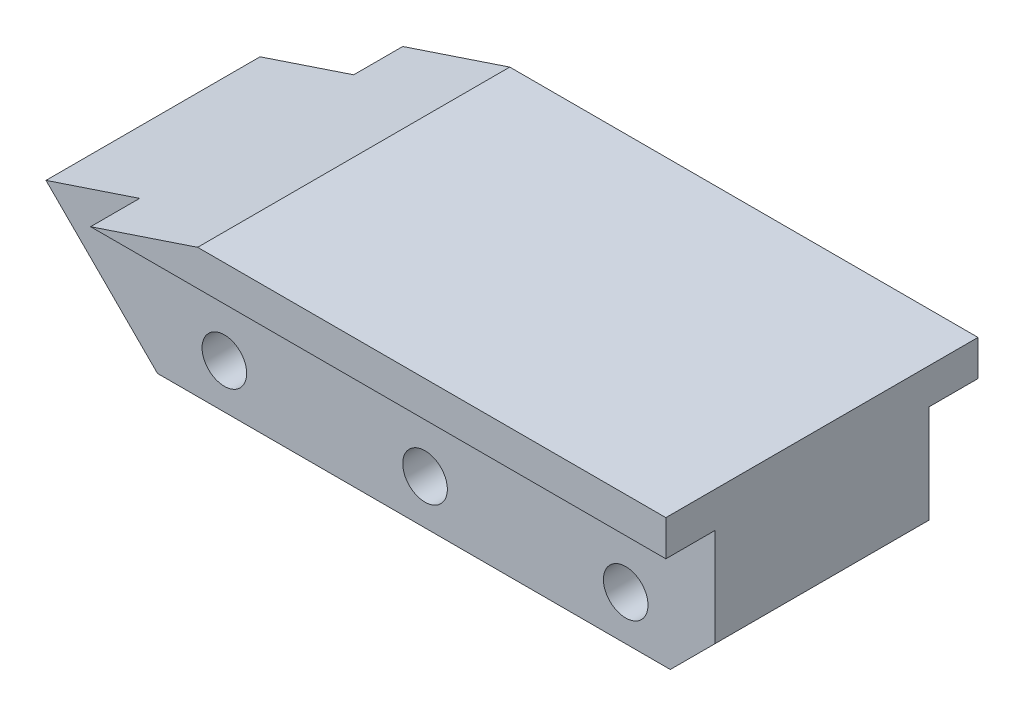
SolidWorks part; units mm, degrees
ref_plane "Front" through (0, 0, 0) normal (0, 0, 1) x (1, 0, 0)
ref_plane "Top" through (0, 0, 0) normal (0, 1, 0) x (1, 0, 0)
ref_plane "Right" through (0, 0, 0) normal (1, 0, 0) x (0, 0, -1)
sketch "Эскиз5" plane through (0, 0, 0) normal (0, 0, 1) x (1, 0, 0)
  line L0 (-49.8795, 2.9762) -> (-4.8795, 17.9762)
  line L1 (-4.8795, 17.9762) -> (100.1205, 17.9762)
  line L2 (-26.0684, -12.0238) -> (104.8667, -12.0238) construction
  line L3 (-24.8795, -22.0238) -> (100.1205, -22.0238)
  line L4 (100.1205, 17.9762) -> (100.1205, -22.0238)
  line L5 (-49.8795, 2.9762) -> (-24.8795, -22.0238)
  circle A0 centre (80.1205, -12.0238) radius 5
  circle A1 centre (35.1205, -12.0238) radius 5
  circle A2 centre (-9.8795, -12.0238) radius 5
  dimension "D7" = 20
  dimension "D8" = 45
  dimension "D9" = 45
  dimension "D1" = 150
  dimension "D2" = 40
  dimension "D3" = 45
  dimension "D4" = 25
  dimension "D5" = 15
  dimension "D6" = 10
extrude "Вытянуть1" add sketch "Эскиз5" along normal blind 70
sketch "Эскиз6" plane through (100.1205, 0, 0) normal (1, 0, 0) x (0, 0, -1)
  line L0 (-70, -22.0238) -> (-70, 17.9762) construction
  line L1 (-70, 9.9762) -> (-59, 9.9762)
  line L2 (-70, 9.9762) -> (-70, -22.0238)
  line L3 (-70, -22.0238) -> (-59, -22.0238)
  line L4 (-59, 9.9762) -> (-59, -22.0238)
  line L5 (-70, -22.0238) -> (0, -22.0238) construction
  line L6 (0, -22.0238) -> (0, 17.9762) construction
  line L7 (0, 9.9762) -> (-11, 9.9762)
  line L8 (0, 9.9762) -> (0, -22.0238)
  line L9 (0, -22.0238) -> (-11, -22.0238)
  line L10 (-11, 9.9762) -> (-11, -22.0238)
  dimension "D1" = 32
  dimension "D2" = 11
  dimension "D3" = 11
  dimension "D4" = 32
extrude "Вырез-Вытянуть3" cut sketch "Эскиз6" against normal through all
chamfer "Фаска3" distance 10 angle 45 1 edges at (100.1205, -22.0238, 35)
